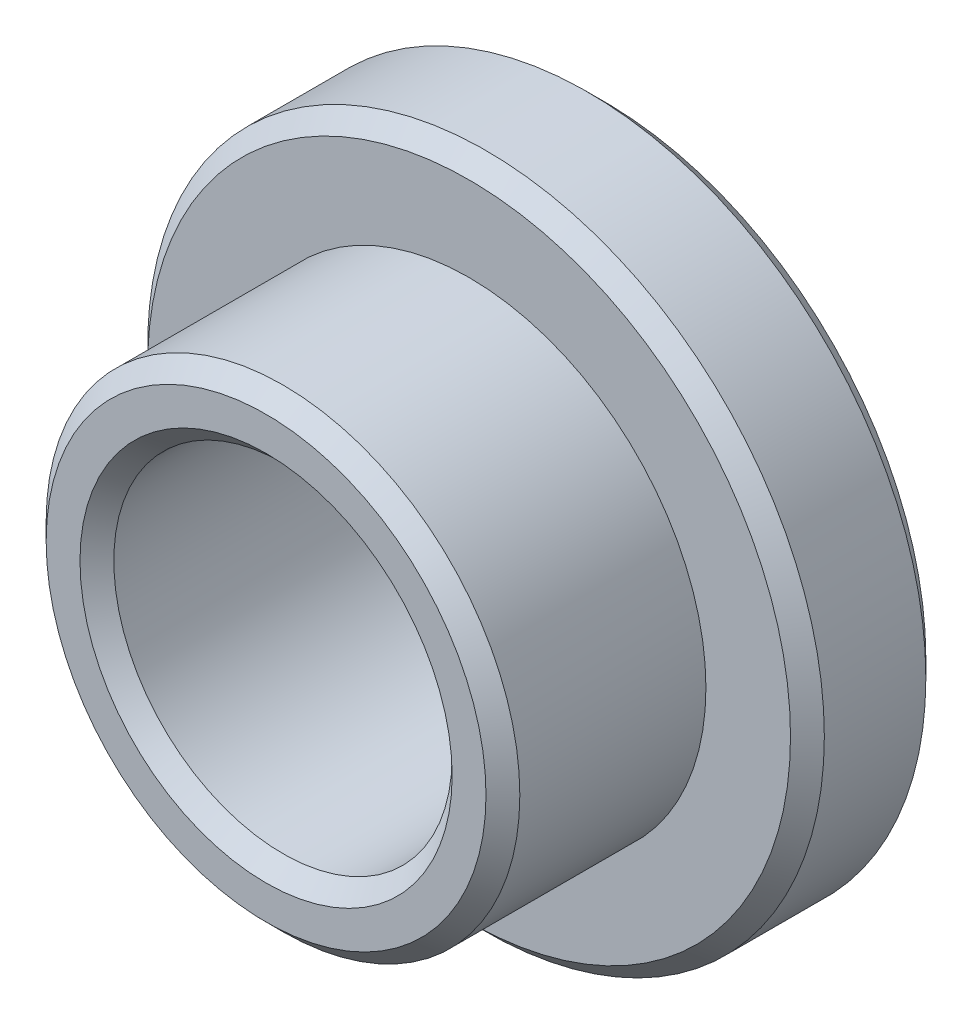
SolidWorks part; units mm, degrees
ref_plane "Front" through (0, 0, 0) normal (0, 0, 1) x (1, 0, 0)
ref_plane "Top" through (0, 0, 0) normal (0, 1, 0) x (1, 0, 0)
ref_plane "Right" through (0, 0, 0) normal (1, 0, 0) x (0, 0, -1)
sketch "Esquisse1" plane through (0, 0, 0) normal (0, 0, 1) x (1, 0, 0)
  circle A0 centre (0, 0) radius 5
  dimension "D1" = 10
extrude "Boss.-Extru.1" add sketch "Esquisse1" along normal blind 2
sketch "Esquisse2" plane through (0, 0, 2) normal (0, 0, 1) x (1, 0, 0)
  circle A0 centre (0, 0) radius 3.5
  dimension "D1" = 7
extrude "Boss.-Extru.2" add sketch "Esquisse2" along normal blind 3
sketch "Esquisse3" plane through (0, 0, 5) normal (0, 0, 1) x (1, 0, 0)
  circle A0 centre (0, 0) radius 2.5
  dimension "D1" = 5
extrude "Enlèv. mat.-Extru.1" cut sketch "Esquisse3" against normal up to next
chamfer "Chanfrein1" distance 0.25 angle 45 5 edges at (2.5, 0, 0) (5, 0, 0) (5, 0, 2) (2.5, 0, 5) (3.5, 0, 5)
sketch "Esquisse4" plane through (0, 0, 0) normal (0, 0, -1) x (-1, 0, 0)
  point P0 (0, 0)
